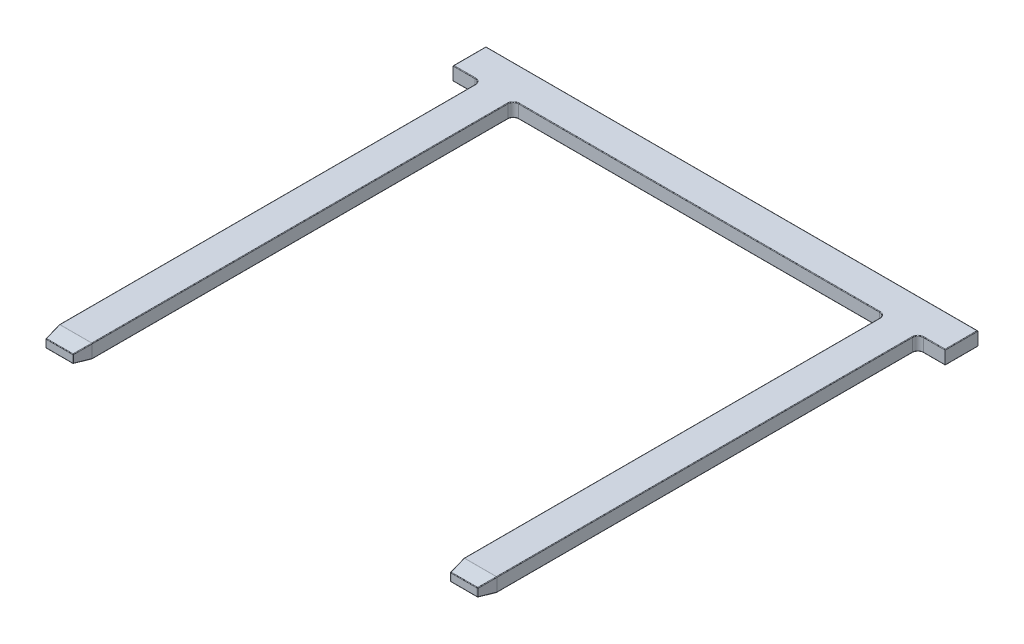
SolidWorks part; units mm, degrees
ref_plane "Front Plane" through (0, 0, 0) normal (0, 0, 1) x (1, 0, 0)
ref_plane "Top Plane" through (0, 0, 0) normal (0, 1, 0) x (1, 0, 0)
ref_plane "Right Plane" through (0, 0, 0) normal (1, 0, 0) x (0, 0, -1)
sketch "Sketch1" plane through (0, 0, 0) normal (0, 1, 0) x (1, 0, 0)
  line L0 (-400, -30) -> (-400, -830)
  line L1 (450, -30) -> (-450, -30)
  line L2 (450, -30) -> (450, 30)
  line L3 (450, 30) -> (-450, 30)
  line L4 (-450, -30) -> (-450, 30)
  line L5 (450, -30) -> (-450, 30) construction
  line L6 (450, 30) -> (-450, -30) construction
  line L7 (-400, -830) -> (-340, -830)
  line L8 (-340, -830) -> (-340, -30)
  line L11 (340, -30) -> (340, -830)
  line L12 (340, -830) -> (400, -830)
  line L13 (400, -830) -> (400, -30)
  point P0 (0, 0)
  dimension "D1" = 60
  dimension "支架宽" = 900
  dimension "D3" = 60
  dimension "D4" = 50
  dimension "D5" = 50
  dimension "D6" = 800
extrude "Boss-Extrude1" add sketch "Sketch1" along normal blind 25 contours L7 L8 L1 L0 | L4 L1 L2 L3 | L12 L13 L1 L11
fillet "Fillet1" radius 10 4 edges at (400, 12.5, 30) (340, 12.5, 30) (-400, 12.5, 30) (-340, 12.5, 30)
chamfer "Chamfer1" distance 5 distance2 30 2 edges at (-370, 0, 830) (-370, 25, 830)
chamfer "Chamfer5" distance 5 distance2 30 2 edges at (370, 0, 830) (370, 25, 830)
chamfer "Chamfer3" distance 5 distance2 30 2 edges at (-340, 12.5, 830) (400, 12.5, 830)
chamfer "Chamfer4" distance 30 distance2 5 2 edges at (-400, 12.5, 830) (340, 12.5, 830)
fillet "Fillet2" radius 1 32 edges at (402.9289, 25, 32.9289) (402.9289, 0, 32.9289) (430, 25, 30) (430, 0, 30) (450, 0, 0) (450, 25, 0) (0, 0, -30) (0, 25, -30) (-450, 0, 0) (-450, 25, 0) (-430, 25, 30) (-430, 0, 30) (-402.9289, 25, 32.9289) (-402.9289, 0, 32.9289) (-400, 0, 420) (-400, 25, 420) (-370, 0, 800) (-340, 25, 420) (-340, 0, 420) (-337.0711, 25, 32.9289) (-337.0711, 0, 32.9289) (0, 25, 30) (0, 0, 30) (337.0711, 25, 32.9289) (337.0711, 0, 32.9289) (340, 0, 420) (340, 25, 420) (370, 0, 800) (400, 25, 420) (400, 0, 420) (-370, 25, 800) (370, 25, 800)
fillet "Fillet3" radius 1 16 edges at (-345, 12.5, 830) (-370, 5, 830) (-395, 12.5, 830) (-370, 20, 830) (397.3536, 22.3536, 815.8787) (397.3536, 2.6464, 815.8787) (395, 12.5, 830) (370, 5, 830) (345, 12.5, 830) (370, 20, 830) (342.6464, 2.6464, 815.8787) (342.6464, 22.3536, 815.8787) (-342.6464, 2.6464, 815.8787) (-342.6464, 22.3536, 815.8787) (-397.3536, 2.6464, 815.8787) (-397.3536, 22.3536, 815.8787)
